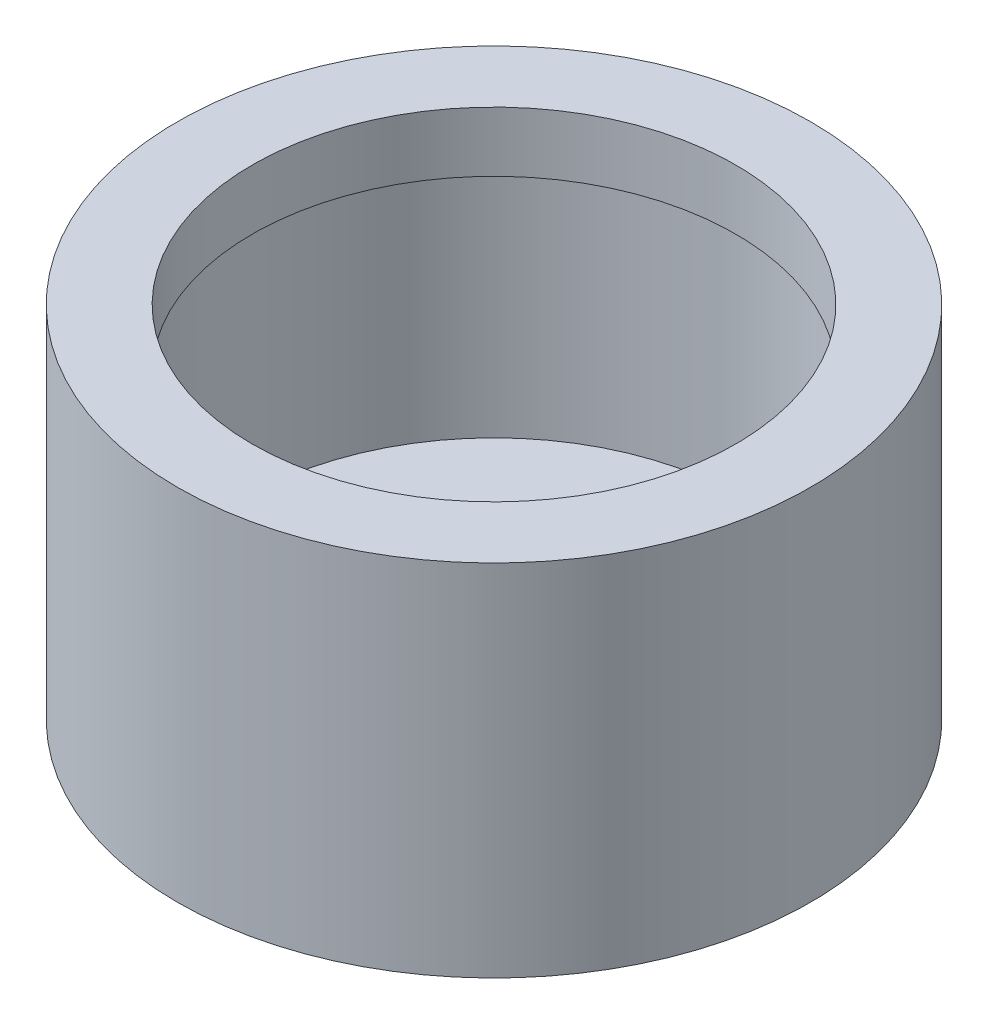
SolidWorks part; units mm, degrees
ref_plane "Front Plane" through (0, 0, 0) normal (0, 0, 1) x (1, 0, 0)
ref_plane "Top Plane" through (0, 0, 0) normal (0, 1, 0) x (1, 0, 0)
ref_plane "Right Plane" through (0, 0, 0) normal (1, 0, 0) x (0, 0, -1)
sketch "Sketch1" plane through (0, 0, 0) normal (0, 0, 1) x (1, 0, 0)
  line L0 (14.351, 0) -> (14.351, -3.556)
  line L1 (14.351, -3.556) -> (14.732, -3.556)
  line L2 (14.732, -3.556) -> (14.732, -17.272)
  line L3 (14.732, -17.272) -> (0, -17.272)
  line L4 (0, -17.272) -> (0, -21.336)
  line L5 (0, -21.336) -> (18.796, -21.336)
  line L6 (18.796, -21.336) -> (18.796, 0)
  line L7 (18.796, 0) -> (14.351, 0)
  line L8 (0, 0) -> (0, -91.4339) construction
  dimension "D1" = 29.464
  dimension "D2" = 28.702
  dimension "D3" = 37.592
  dimension "D4" = 3.556
  dimension "D5" = 17.272
  dimension "D6" = 21.336
revolve "Body" add sketch "Sketch1" angle 360 about L8
sketch "Hole Locations" plane through (0, -21.336, 0) normal (0, -1, 0) x (1, 0, 0)
  line L0 (-7.62, 14.732) -> (7.62, 14.732) construction
  line L1 (0, 14.732) -> (0, 0) construction
  line L2 (0, 18.796) -> (0, 14.732) construction
  circle A0 centre (0, 0) radius 18.796 construction
  dimension "D1" = 7.62
  dimension "D2" = 4.064
hole_wizard "#4-40 Tapped Hole1" positions "3DSketch1" profile "Sketch3" tap size "#4-40" standard "Ansi Inch"
sketch3d "3DSketch1"
  point P0 (-7.62, -21.336, 14.732)
  point P3 (7.62, -21.336, 14.732)
sketch "Sketch3" plane through (-7.62, -21.336, 14.732) normal (1, 0, 0) x (0, 0, -1)
  line L0 (0, 0) -> (0, 5.7592)
  line L1 (0, 5.7592) -> (1.1303, 5.08)
  line L2 (1.1303, 5.08) -> (1.1303, 0)
  line L5 (1.1303, 0) -> (0, 0)
  line L10 (0, 5.7592) -> (-1.1303, 5.08) construction
  line L11 (0, -6.35) -> (0, 107.95) construction
  dimension "Tap Drill Dia." = 2.2606
  dimension "Tap Drill Depth" = 5.08
  dimension "Drill Angle" = 118
